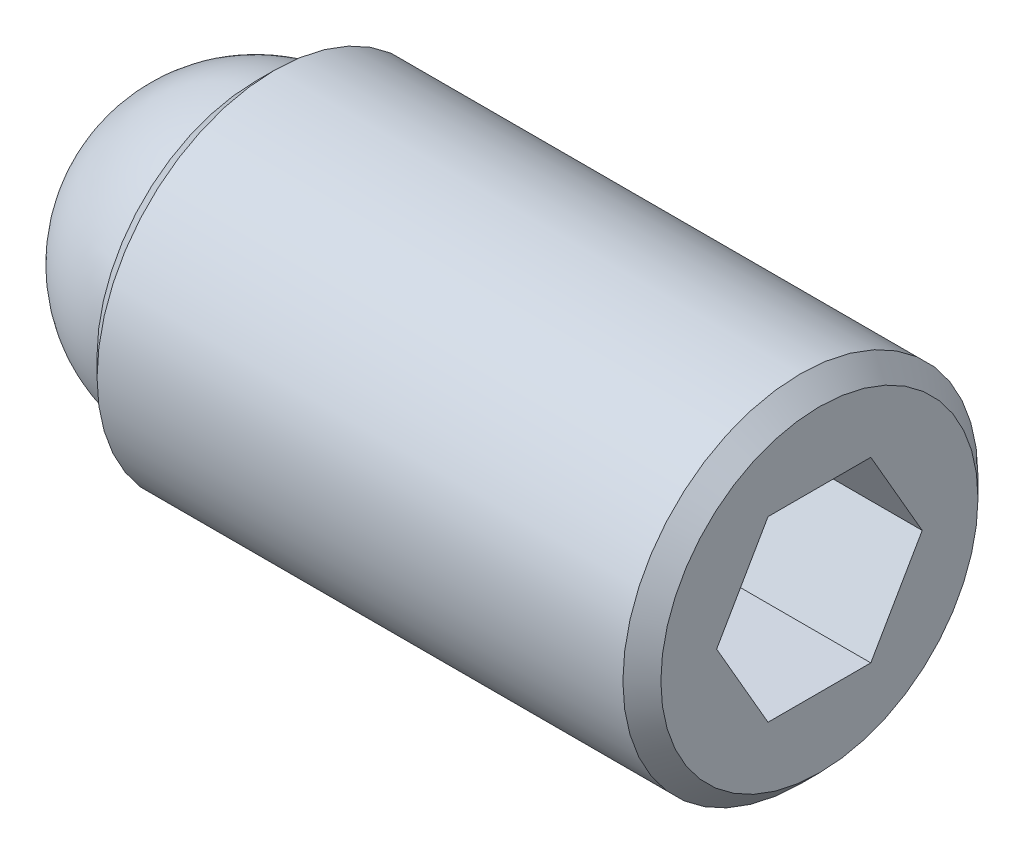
SolidWorks part; units mm, degrees
ref_plane "Front Plane" through (0, 0, 0) normal (0, 0, 1) x (1, 0, 0)
ref_plane "Top Plane" through (0, 0, 0) normal (0, 1, 0) x (1, 0, 0)
ref_plane "Right Plane" through (0, 0, 0) normal (1, 0, 0) x (0, 0, -1)
sketch "Sketch2" plane through (0, 0, 0) normal (1, 0, 0) x (0, 0, -1)
  circle A0 centre (0, 0) radius 2.3749
  dimension "D1" = 4.7498
extrude "Boss-Extrude1" add sketch "Sketch2" along normal blind 7.5406
sketch "Sketch3" plane through (0, 0, 0) normal (-1, 0, 0) x (0, 0, 1)
  circle A0 centre (0, 0) radius 1.9812
  dimension "D1" = 3.9624
chamfer "Chamfer1" distance 0.254 angle 45 1 edges at (0, 0, -2.3749)
chamfer "Chamfer2" distance 0.254 angle 45 1 edges at (7.5406, 0, -2.3749)
sketch "Sketch4" plane through (7.5406, 0, 0) normal (1, 0, 0) x (0, 0, -1)
  line L1 (1.3748, 0) -> (0.6874, 1.1906)
  line L2 (0.6874, 1.1906) -> (-0.6874, 1.1906)
  line L3 (-0.6874, 1.1906) -> (-1.3748, 0)
  line L4 (-1.3748, 0) -> (-0.6874, -1.1906)
  line L5 (-0.6874, -1.1906) -> (0.6874, -1.1906)
  line L6 (0.6874, -1.1906) -> (1.3748, 0)
  circle A0 centre (0, 0) radius 1.1906 construction
  dimension "D1" = 2.3813
extrude "Cut-Extrude2" cut sketch "Sketch4" against normal blind 2.286
extrude "Cut-Extrude3" cut sketch "Sketch3" against normal blind 1.9844
sketch "Sketch5" plane through (0, 0, 0) normal (-1, 0, 0) x (0, 0, 1)
  line L0 (0, 0) -> (0, -1.9844)
  line L1 (0, 0) -> (0, 1.9844)
  arc A0 (0, 1.9844) -> (0, -1.9844) centre (0, 0) ccw
  dimension "D1" = 1.9844
revolve "Revolve1" add sketch "Sketch5" angle 360 about L1
sketch "Sketch6" plane through (0, 0, 0) normal (-1, 0, 0) x (0, 0, 1)
  line L0 (0, 0) -> (0, 1.9844) construction
  arc A0 (0.0634, 1.9802) -> (-0.0634, 1.9802) centre (0, 0) ccw
  circle A1 centre (0, 0) radius 1.9844 construction
  arc A2 (0.0634, 1.9802) -> (-0.0634, 1.9802) centre (0, 1.9844) ccw
  dimension "D1" = 0.127
  dimension "D2" = 3.9624
extrude "Cut-Extrude5" cut sketch "Sketch6" against normal up to surface (1.9844 mm away)
